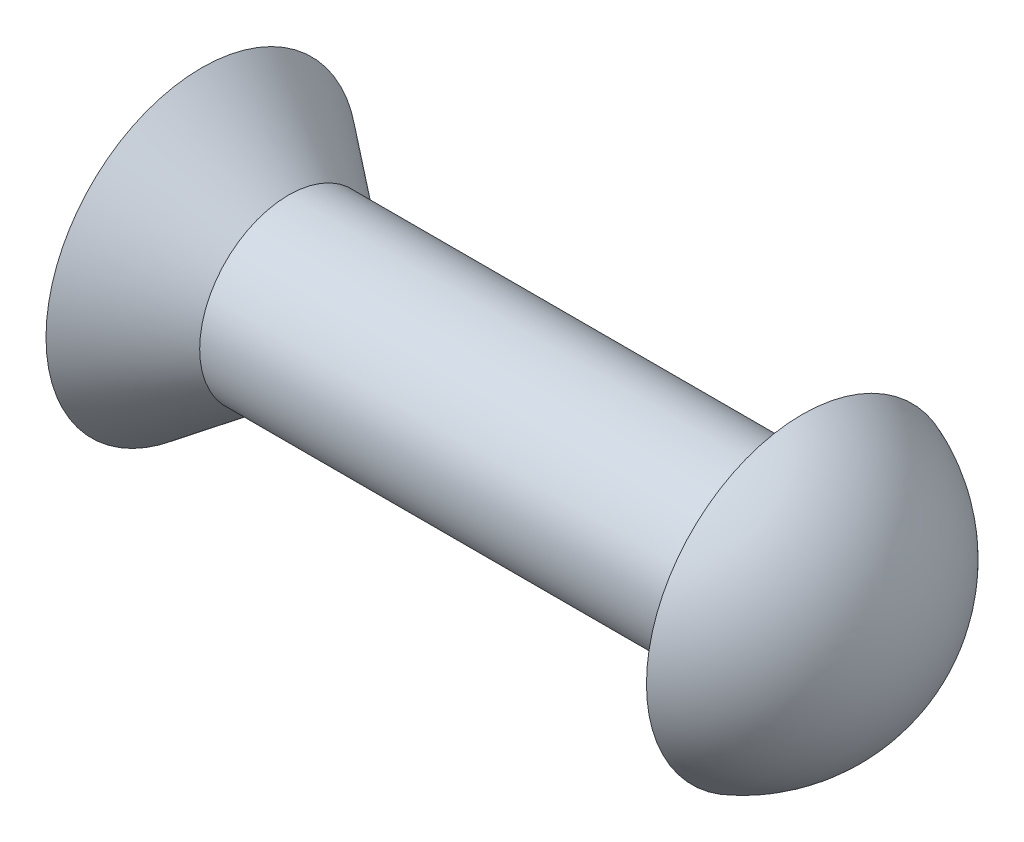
SolidWorks part; units mm, degrees
ref_plane "Plane1" through (0, 0, 0) normal (0, 0, 1) x (1, 0, 0)
ref_plane "Plane2" through (0, 0, 0) normal (0, 1, 0) x (1, 0, 0)
ref_plane "Plane3" through (0, 0, 0) normal (1, 0, 0) x (0, 0, -1)
sketch "Sketch1" plane through (0, 0, 0) normal (0, 0, 1) x (1, 0, 0)
  line L0 (-34, 0) -> (6, 0) construction
  line L1 (-27, 0) -> (0, 0)
  line L2 (0, 4) -> (-23.0903, 4)
  line L3 (-23.0903, 4) -> (-27, 7)
  line L4 (0, 4) -> (0, 0)
  line L5 (-27, 7) -> (-27, 0)
  line L6 (-23.0903, -4) -> (-27, -7) construction
  dimension "D1" = 75
  dimension "Diameter" = 8
  dimension "GripLength" = 27
  dimension "HeadDia" = 14
revolve "Base-Revolve" add sketch "Sketch1" angle 360 about L0
sketch "Sketch2" plane through (0, 0, 0) normal (0, 0, 1) x (1, 0, 0)
  line L0 (-32, 0) -> (8, 0) construction
  line L1 (0, 0) -> (4.8, 0)
  line L2 (0, 0) -> (0, 7)
  arc A0 (4.8, 0) -> (0, 7) centre (-2.7, 0.0029) ccw
  dimension "D1" = 14
  dimension "HeadRad" = 7.5
  dimension "HeadHt" = 4.8
revolve "HeadTypeA" add sketch "Sketch2" angle 360 about L0
sketch "Sketch3" plane through (0, 0, 0) normal (0, 0, 1) x (1, 0, 0)
  line L0 (3, 0) -> (-30, 0) construction
  line L1 (-34, 0) -> (6, 0) construction
  line L2 (0, 0) -> (0, 7)
  line L3 (0, 7) -> (-3.9097, 4)
  line L4 (-3.9097, 0) -> (0, 0)
  line L5 (0, -7) -> (-3.9097, -4) construction
  line L9 (-3.9097, 4) -> (-3.9097, 0)
  dimension "D1" = 8
  dimension "D2" = 75
  dimension "D3" = 14
revolve "HeadTypeB" [suppressed] add sketch "Sketch3" angle 360 about L0
equation "\"D1@Sketch2\" = \"HeadDia@Sketch1\""
equation "\"D3@Sketch3\" = \"HeadDia@Sketch1\""
equation "\"D1@Sketch3\" = \"Diameter@Sketch1\""
